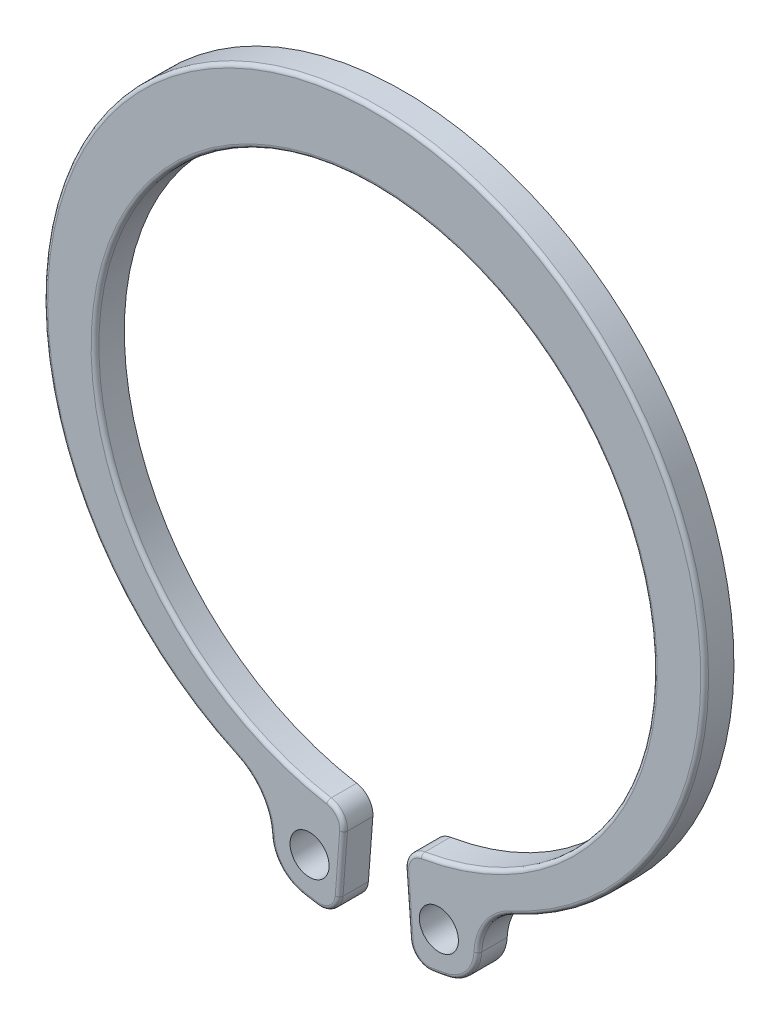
SolidWorks part; units mm, degrees
ref_plane "Face" through (0, 0, 0) normal (0, 0, 1) x (1, 0, 0)
ref_plane "Dessus" through (0, 0, 0) normal (0, 1, 0) x (1, 0, 0)
ref_plane "Droite" through (0, 0, 0) normal (1, 0, 0) x (0, 0, -1)
sketch "Esquisse1" plane through (0, 0, 0) normal (0, 0, 1) x (1, 0, 0)
  line L0 (0, 17.8) -> (0, 14.3) construction
  line L1 (1.4969, -14.2214) -> (1.8774, -19.2069)
  line L2 (-1.4969, -14.2214) -> (-1.8774, -19.2069)
  line L3 (0.4, -13.9443) -> (0.4, -18.9443) construction
  line L4 (-0.4, -13.9443) -> (-0.4, -18.9443) construction
  arc A0 (1.4969, -14.2214) -> (-1.4969, -14.2214) centre (0, 0) ccw
  arc A1 (7.0548, -14.5096) -> (-7.0548, -14.5096) centre (0, 0.875) ccw
  arc A2 (1.8774, -19.2069) -> (3.6949, -18.9415) centre (0, 0) ccw
  circle A3 centre (3.312, -16.9785) radius 1
  arc A4 (3.6949, -18.9415) -> (5.3093, -17.0817) centre (3.312, -16.9785) ccw
  arc A5 (7.0548, -14.5096) -> (5.3093, -17.0817) centre (8.3053, -17.2365) ccw
  circle A6 centre (-3.312, -16.9785) radius 1
  arc A7 (-7.0548, -14.5096) -> (-5.3093, -17.0817) centre (-8.3053, -17.2365) cw
  arc A8 (-3.6949, -18.9415) -> (-5.3093, -17.0817) centre (-3.312, -16.9785) cw
  arc A9 (-1.8774, -19.2069) -> (-3.6949, -18.9415) centre (0, 0) cw
  arc A10 (0.4, -13.9443) -> (-0.4, -13.9443) centre (0, 0) ccw construction
  circle A11 centre (0, 0) radius 15 construction
  dimension "dgorge" = 28.6
  dimension "D3" = 0.875
  dimension "dtrou" = 2
  dimension "D8" = 2
  dimension "D9" = 3
  dimension "dint" = 27.9
  dimension "dn" = 30
  dimension "b" = 3.5
  dimension "a" = 5
  dimension "D5" = 12.017
  dimension "D7" = 1.6
  dimension "D12" = 0.8
  dimension "D13" = 3.286
  dimension "D14" = 4.365
extrude "Base-Extrusion" add sketch "Esquisse1" along normal blind 1.5
fillet "Congé1" radius 1 4 edges at (1.8774, -19.2069, 0.75) (-1.8774, -19.2069, 0.75) (1.4969, -14.2214, 0.75) (-1.4969, -14.2214, 0.75)
fillet "Congé2" radius 0.2 14 edges at (-1.7775, -14.4678, 1.5) (-1.683, -16.6597, 1.5) (-2.1731, -18.8672, 1.5) (-3.3218, -19.0104, 1.5) (-4.8223, -18.2895, 1.5) (-5.823, -15.5519, 1.5) (0, 17.8, 1.5) (5.823, -15.5519, 1.5) (4.8223, -18.2895, 1.5) (3.3218, -19.0104, 1.5) (2.1731, -18.8672, 1.5) (1.683, -16.6597, 1.5) (1.7775, -14.4678, 1.5) (0, 14.3, 1.5)
equation "\"D3@Esquisse1\" = \"b@Esquisse1\"/4"
equation "\"D7@Esquisse1\"=\"dtrou@Esquisse1\"*0.8"
equation "\"D8@Esquisse1\" = \"dtrou@Esquisse1\""
equation "\"D9@Esquisse1\" = \"dtrou@Esquisse1\"*1.5"
equation "\"D12@Esquisse1\" = \"dtrou@Esquisse1\"*0.4"
equation "\"D5@Esquisse1\" = 360-(360-\"D13@Esquisse1\")*\"dint@Esquisse1\"/\"dgorge@Esquisse1\""
equation "\"D14@Esquisse1\" = (\"D5@Esquisse1\"-\"D13@Esquisse1\")/2"
